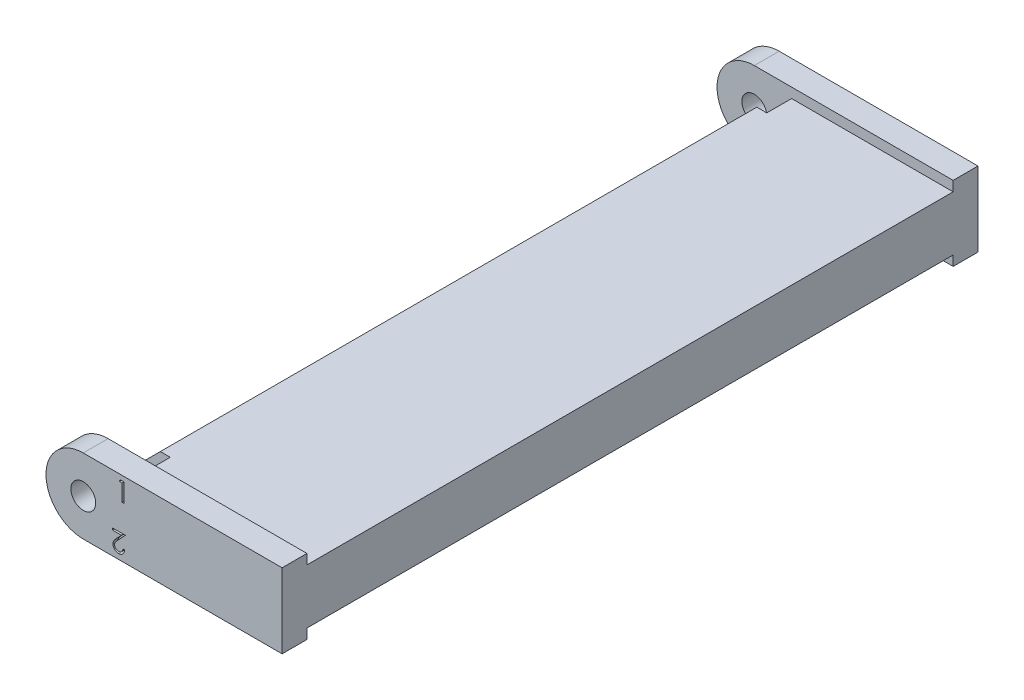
SolidWorks part; units mm, degrees
ref_plane "Plane1" through (0, 0, 0) normal (0, 0, 1) x (1, 0, 0)
ref_plane "Plane2" through (0, 0, 0) normal (0, 1, 0) x (1, 0, 0)
ref_plane "Plane3" through (0, 0, 0) normal (1, 0, 0) x (0, 0, -1)
sketch "Sketch1" plane through (0, 0, 0) normal (0, 0, 1) x (1, 0, 0)
  line L1 (-76.2, 19.05) -> (76.2, 19.05)
  line L3 (-76.2, -19.05) -> (76.2, -19.05)
  arc A0 (76.2, 19.05) -> (76.2, -19.05) centre (76.2, 0) cw
  arc A1 (-76.2, -19.05) -> (-76.2, 19.05) centre (-76.2, 0) cw
  point P6 (0, -19.05)
  dimension "D1" = 152.4
  dimension "D2" = 19.05
extrude "Base-Extrude" add sketch "Sketch1" along normal blind 12.7
sketch "Sketch2" plane through (0, 0, 12.7) normal (0, 0, 1) x (1, 0, 0)
  circle A0 centre (76.2, 0) radius 6.35
  circle A1 centre (-76.2, 0) radius 6.35
  dimension "D1" = 12.7
sketch "Sketch4" plane through (0, 0, 0) normal (0, 0, -1) x (-1, 0, 0)
  line L0 (-76.2, 19.05) -> (76.2, 19.05) construction
  line L1 (76.2, -13.97) -> (-76.2, -13.97)
  line L2 (76.2, -13.97) -> (76.2, 13.97)
  line L3 (76.2, 13.97) -> (-76.2, 13.97)
  line L4 (-76.2, -13.97) -> (-76.2, 13.97)
  line L5 (76.2, -19.05) -> (-76.2, -19.05) construction
  dimension "D3" = 5.08
  dimension "D4" = 5.08
extrude "Boss-Extrude2" add sketch "Sketch4" along normal blind 330.2
sketch "Sketch6" plane through (4.8861, -2.859, -330.2) normal (0, 0, -1) x (-1, 0, 0)
  line L1 (-71.3139, 21.909) -> (81.0861, 21.909)
  line L3 (-71.3139, -16.191) -> (81.0861, -16.191)
  arc A0 (81.0861, 21.909) -> (81.0861, -16.191) centre (81.0861, 2.859) cw
  arc A1 (-71.3139, -16.191) -> (-71.3139, 21.909) centre (-71.3139, 2.859) cw
  arc A2 (81.0861, -16.191) -> (81.0861, 21.909) centre (81.0861, 2.859) ccw construction
  point P6 (4.8861, -16.191)
  dimension "D1" = 152.4
  dimension "D2" = 19.05
extrude "Boss-Extrude3" add sketch "Sketch6" along normal blind 12.7
sketch "Sketch7" plane through (67.1637, -3.0467, -342.9) normal (0, 0, -1) x (-1, 0, 0)
  circle A0 centre (143.3637, 3.0467) radius 6.35
  circle A1 centre (-9.0363, 3.0467) radius 6.35
  arc A4 (143.3637, -16.0033) -> (143.3637, 22.0967) centre (143.3637, 3.0467) ccw construction
  arc A5 (-9.0363, 22.0967) -> (-9.0363, -16.0033) centre (-9.0363, 3.0467) ccw construction
  dimension "D1" = 12.7
chamfer "Chamfer2" distance 13.97 angle 45 8 edges at (-76.2, 0, 0) (-76.2, -13.97, -165.1) (-76.2, 13.97, -165.1) (76.2, 0, 0) (76.2, 13.97, -165.1) (76.2, -13.97, -165.1) (-76.2, 0, -330.2) (76.2, 0, -330.2)
sketch "Sketch8" plane through (0, 13.97, 0) normal (0, 1, 0) x (-1, 0, 0)
  line L0 (-76.2, 0) -> (76.2, 0) construction
  line L1 (-129.3881, -330.2) -> (-57.15, -330.2)
  line L2 (-129.3881, -330.2) -> (-129.3881, 0)
  line L3 (-129.3881, 0) -> (-57.15, 0)
  line L4 (-57.15, -330.2) -> (-57.15, -317.5)
  line L6 (-57.15, -12.7) -> (-57.15, 0)
  line L7 (-57.15, -12.7) -> (-101.6, -12.7)
  line L8 (76.2, -330.2) -> (-76.2, -330.2) construction
  line L9 (-57.15, -317.5) -> (-101.6, -317.5)
  line L10 (-101.6, -12.7) -> (-101.6, -317.5)
  dimension "D1" = 19.05
  dimension "D2" = 27.7881
  dimension "D3" = 25.4
  dimension "D4" = 12.7
extrude "Cut-Extrude1" cut sketch "Sketch8" against normal through all
mirror "Mirror1" about plane through (0, 0, 0) normal (1, 0, 0) of "Cut-Extrude1"
extrude "Cut-Extrude2" cut sketch "Sketch2" against normal up to surface (12.7 mm away)
extrude "Cut-Extrude3" cut sketch "Sketch7" against normal up to surface (12.7 mm away)
ref_plane "Plane4" through (25.4, 0, 0) normal (1, 0, 0) x (0, 0, -1)
sketch "Sketch9" plane through (25.4, 0, 0) normal (1, 0, 0) x (0, 0, -1)
  line L1 (-28.9091, 50.5858) -> (360.6845, 50.5858)
  line L2 (-28.9091, 50.5858) -> (-28.9091, -83.5727)
  line L3 (-28.9091, -83.5727) -> (360.6845, -83.5727)
  line L4 (360.6845, 50.5858) -> (360.6845, -83.5727)
extrude "Cut-Extrude4" cut sketch "Sketch9" along normal blind 127
sketch "Sketch10" plane through (0, 0, 0) normal (0, 0, -1) x (-1, 0, 0)
  circle A0 centre (76.2, 0) radius 6.35 construction
  point P0 (76.2, 0)
sketch "Sketch11" plane through (0, 0, -330.2) normal (0, 0, 1) x (1, 0, 0)
  circle A0 centre (-76.2, 0) radius 6.35 construction
  point P0 (-76.2, 0)
sketch "Sketch12" plane through (0, 0, 12.7) normal (0, 0, 1) x (1, 0, 0)
  text T0 "1" font "Century Gothic" height in points 36
  text T1 "<r180>2</r>" font "Century Gothic" height in points 36
extrude "Cut-Extrude5" cut sketch "Sketch12" against normal blind 2.54
sketch "Sketch13" plane through (0, 0, -342.9) normal (0, 0, -1) x (-1, 0, 0)
  text T0 "1" font "Century Gothic" height in points 36
  text T1 "<r180>2</r>" font "Century Gothic" height in points 36
extrude "Cut-Extrude6" cut sketch "Sketch13" against normal blind 2.54
